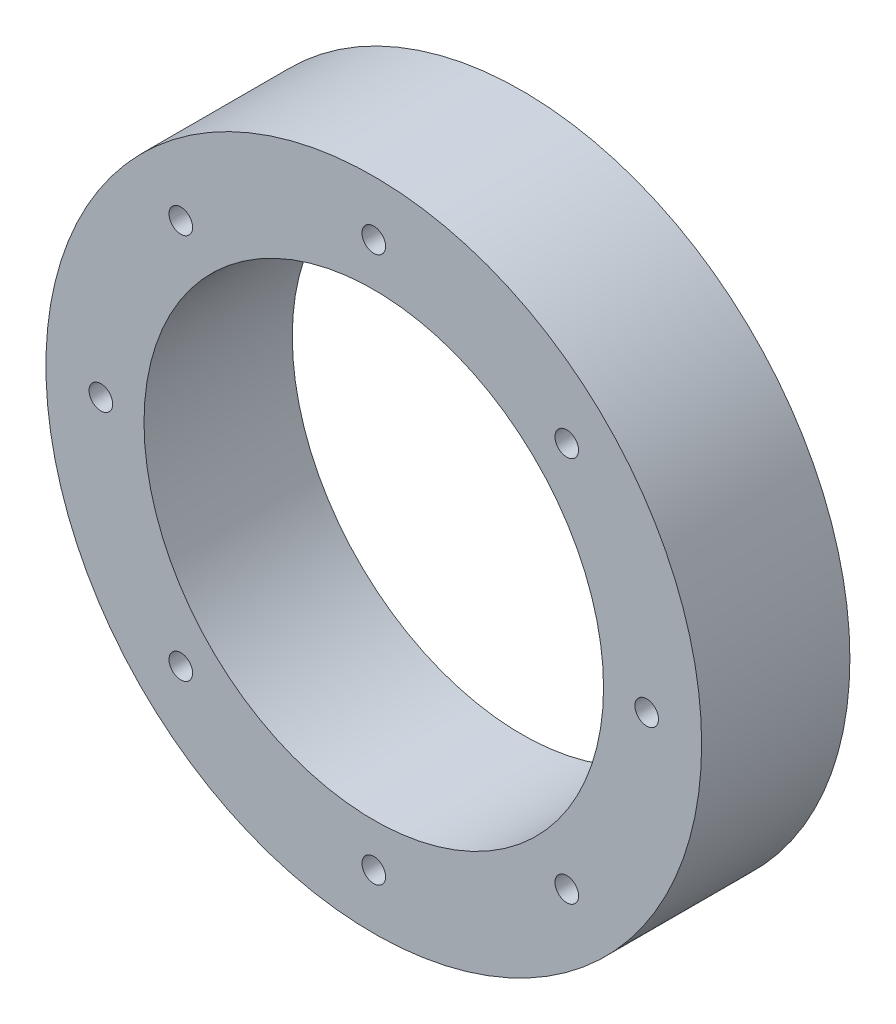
SolidWorks part; units mm, degrees
ref_plane "Front Plane" through (0, 0, 0) normal (1, 0, 0) x (0, 1, 0)
ref_plane "Top Plane" through (0, 0, 0) normal (0, 0, 1) x (0, 1, 0)
ref_plane "Right Plane" through (0, 0, 0) normal (0, 1, 0) x (-1, 0, 0)
sketch "Sketch1" plane through (0, 0, 0) normal (0, 0, 1) x (0, 1, 0)
  line L0 (0, 0) -> (37, 0) construction
  circle A0 centre (0, 0) radius 31.15
  circle A1 centre (0, 0) radius 44.45
  circle A2 centre (37, 0) radius 1.6
  circle A3 centre (26.163, -26.163) radius 1.6
  circle A4 centre (0, -37) radius 1.6
  circle A5 centre (-26.163, -26.163) radius 1.6
  circle A6 centre (-37, 0) radius 1.6
  circle A7 centre (-26.163, 26.163) radius 1.6
  circle A8 centre (0, 37) radius 1.6
  circle A9 centre (26.163, 26.163) radius 1.6
  dimension "D1" = 62.3
  dimension "D2" = 88.9
  dimension "D3" = 3.2
  dimension "D4" = 37
  dimension "D5" = 8
extrude "Boss-Extrude1" add sketch "Sketch1" along normal mid plane 20.1
